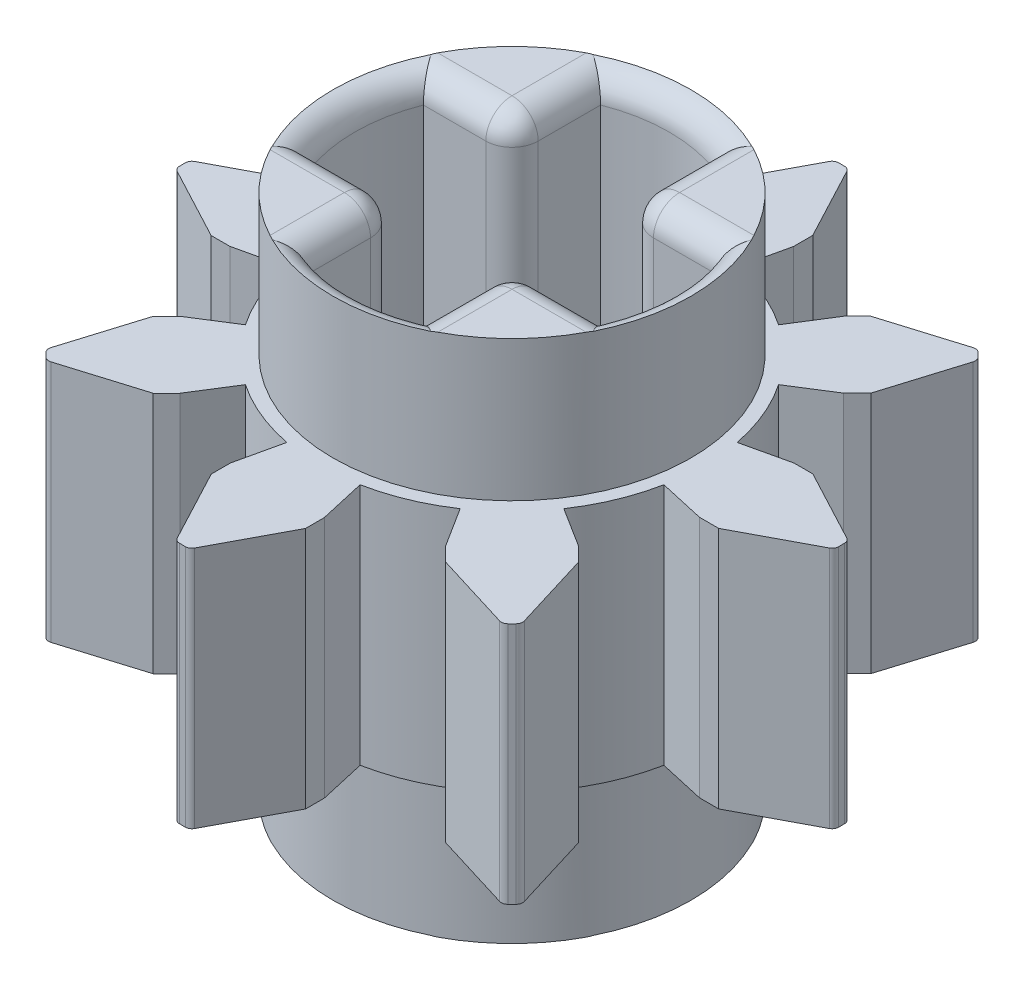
SolidWorks part; units mm, degrees
ref_plane "Front Plane" through (0, 0, 0) normal (0, 0, 1) x (1, 0, 0)
ref_plane "Top Plane" through (0, 0, 0) normal (0, 1, 0) x (1, 0, 0)
ref_plane "Right Plane" through (0, 0, 0) normal (1, 0, 0) x (0, 0, -1)
imported_body "Imported1"
sketch "Sketch1" plane through (0, 4.0325, 0) normal (0, 1, 0) x (1, 0, 0)
  circle A0 centre (0, 0) radius 2.7325
extrude "Boss-Extrude1" add sketch "Sketch1" against normal up to surface (8.065 mm away)
sketch "Sketch2" plane through (0, 4.0325, 0) normal (0, 1, 0) x (1, 0, 0)
  circle A0 centre (0, 0) radius 2.7325
extrude "Cut-Extrude1" cut sketch "Sketch2" against normal blind 0.0325
mirror "Mirror1" about plane through (0, 0, 0) normal (0, 1, 0) of "Cut-Extrude1"
sketch "Sketch3" plane through (0, 4, 0) normal (0, 1, 0) x (1, 0, 0)
  line L0 (-0.88, 2.2328) -> (-0.88, 1.28)
  line L1 (0.88, -2.2328) -> (0.88, -1.28)
  line L2 (2.2328, 0.88) -> (1.28, 0.88)
  line L3 (-2.2328, -0.88) -> (-1.28, -0.88)
  line L4 (-1.28, 0.88) -> (-2.2328, 0.88)
  line L5 (-0.88, -1.28) -> (-0.88, -2.2328)
  line L6 (0.88, 1.28) -> (0.88, 2.2328)
  line L7 (1.28, -0.88) -> (2.2328, -0.88)
  arc A0 (0.88, 2.2328) -> (-0.88, 2.2328) centre (0, 0) ccw
  arc A2 (2.2328, -0.88) -> (2.2328, 0.88) centre (0, 0) ccw
  arc A3 (-0.88, -2.2328) -> (0.88, -2.2328) centre (0, 0) ccw
  arc A4 (-2.2328, 0.88) -> (-2.2328, -0.88) centre (0, 0) ccw
  arc A5 (-0.88, -1.28) -> (-1.28, -0.88) centre (-1.28, -1.28) ccw
  arc A6 (0.88, -1.28) -> (1.28, -0.88) centre (1.28, -1.28) cw
  arc A7 (1.28, 0.88) -> (0.88, 1.28) centre (1.28, 1.28) cw
  arc A8 (-1.28, 0.88) -> (-0.88, 1.28) centre (-1.28, 1.28) ccw
  point P18 (0.88, -0.88)
  point P21 (0.88, 0.88)
  dimension "D1" = 0.88
  dimension "D5" = 0.4
  dimension "D2" = 1.76
  dimension "D3" = 0.88
  dimension "D4" = 1.76
extrude "Cut-Extrude2" cut sketch "Sketch3" against normal through all
fillet "Fillet3" radius 0.4 16 edges at (-0.9972, -4, -0.9972) (-0.9972, -4, 0.9972) (0.9972, -4, 0.9972) (0.9972, -4, -0.9972) (0, -4, -2.4) (-0.88, -4, -1.7564) (-1.7564, -4, -0.88) (-2.4, -4, 0) (-1.7564, -4, 0.88) (-0.88, -4, 1.7564) (0, -4, 2.4) (0.88, -4, 1.7564) (1.7564, -4, 0.88) (2.4, -4, 0) (1.7564, -4, -0.88) (0.88, -4, -1.7564)
fillet "Fillet4" radius 0.4 16 edges at (0.88, 4, 1.7564) (-2.4, 4, 0) (-1.7564, 4, 0.88) (-0.9972, 4, 0.9972) (-0.88, 4, 1.7564) (0, 4, 2.4) (0.9972, 4, 0.9972) (1.7564, 4, 0.88) (2.4, 4, 0) (1.7564, 4, -0.88) (0.9972, 4, -0.9972) (0.88, 4, -1.7564) (0, 4, -2.4) (-0.88, 4, -1.7564) (-0.9972, 4, -0.9972) (-1.7564, 4, -0.88)
sketch "Sketch4" plane through (0, 1.855, 0) normal (0, 1, 0) x (1, 0, 0)
  line L0 (-0.7206, 3.8735) -> (-0.1329, 4.9784)
  line L1 (-0.5595, 2.8786) -> (-0.7206, 3.5868)
  line L2 (-0.7206, 3.5868) -> (-0.7206, 3.8735)
  line L3 (-0.0446, 5.0314) -> (0.0445, 5.0314)
  line L4 (0.1329, 4.9782) -> (0.7178, 3.8746)
  line L5 (0.7178, 3.8746) -> (0.7178, 3.5811)
  line L6 (0.7178, 3.5811) -> (0.5595, 2.8786)
  line L7 (0.7704, 3.5825) -> (0.5595, 2.8786) construction
  line L8 (-0.5595, 2.8786) -> (-1.2784, 4.5764)
  line L9 (-1.2784, 4.5764) -> (0.0445, 5.5647)
  line L10 (0.0445, 5.5647) -> (1.1543, 4.5764)
  line L11 (1.1543, 4.5764) -> (0.5595, 2.8786)
  arc A2 (0.0445, 5.0314) -> (0.1329, 4.9782) centre (0.0445, 4.9314) cw
  arc A3 (-0.1329, 4.9784) -> (-0.0446, 5.0314) centre (-0.0446, 4.9314) cw
  point P13 (0.1047, 5.0314)
  point P18 (-0.1047, 5.0314)
  dimension "D4" = 0.1
  dimension "D1" = 0.05
  dimension "D2" = 0.05
  dimension "D3" = 0
extrude "Cut-Extrude3" cut sketch "Sketch4" against normal through all
pattern_circular "CirPattern1" count 8 every 45 about axis through (0, 0, 0) along (0, 1, 0) of "Cut-Extrude3"
